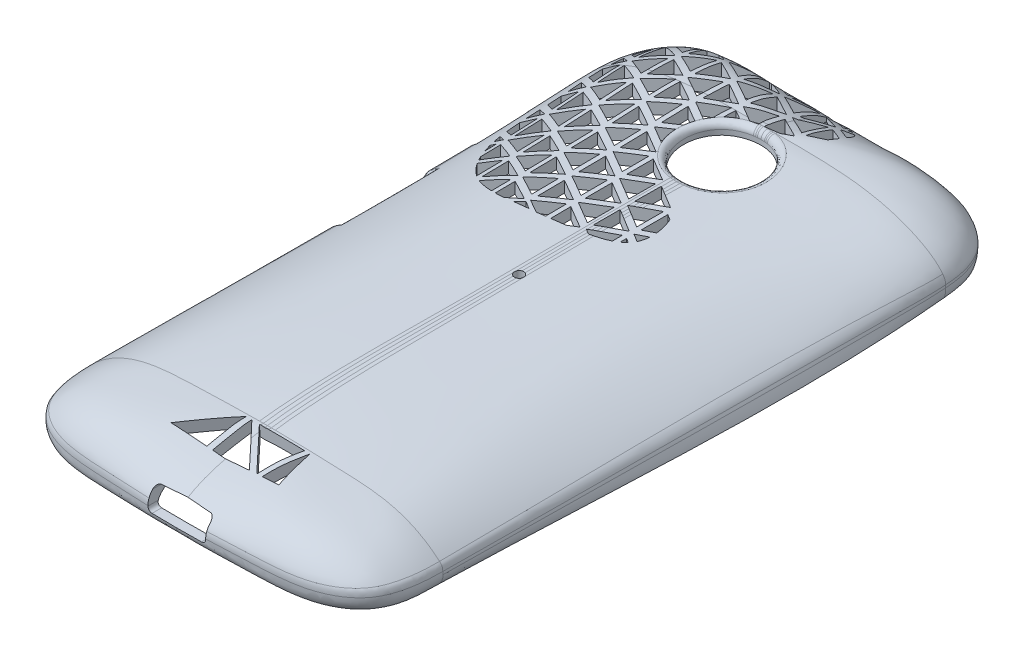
SolidWorks part; units mm, degrees
other "Cortar-Extruir7"
ref_plane "Front Plane" through (0, 0, 0) normal (0, 0, 1) x (1, 0, 0)
ref_plane "Top Plane" through (0, 0, 0) normal (0, 1, 0) x (1, 0, 0)
ref_plane "Right Plane" through (0, 0, 0) normal (1, 0, 0) x (0, 0, -1)
imported_body "Imported1"
scale "Scale1" scale about centroid uniform scaling yes scale factor 0.8
sketch "Sketch1" plane through (0, 0, 0) normal (0, 1, 0) x (1, 0, 0)
  line L0 (34.3385, -2.1253) -> (-32.9705, -99.1055) construction
  circle A0 centre (0.684, -50.6154) radius 0.9075
  spline S0 degree 5 poles (1.5652, -37.0051) (1.5648, -37.3066) (1.5623, -40.0333) (1.5664, -45.1852) (1.5939, -52.7612) (1.6529, -61.5526) (1.7334, -71.2546) (1.8045, -79.7452) (1.855, -86.4137) (1.8868, -91.2604) (1.9062, -94.8891) (1.9169, -97.3052) (1.9215, -98.5103) (1.9237, -99.1121) knots -0.000001 -0.000001 -0.000001 -0.000001 -0.000001 -0.000001 0.015541 0.140541 0.265541 0.390541 0.453041 0.515541 0.578041 0.609291 0.640541 0.640541 0.640541 0.640541 0.640541 0.640541 construction
extrude "Cut-Extrude1" cut sketch "Sketch1" along normal through all
